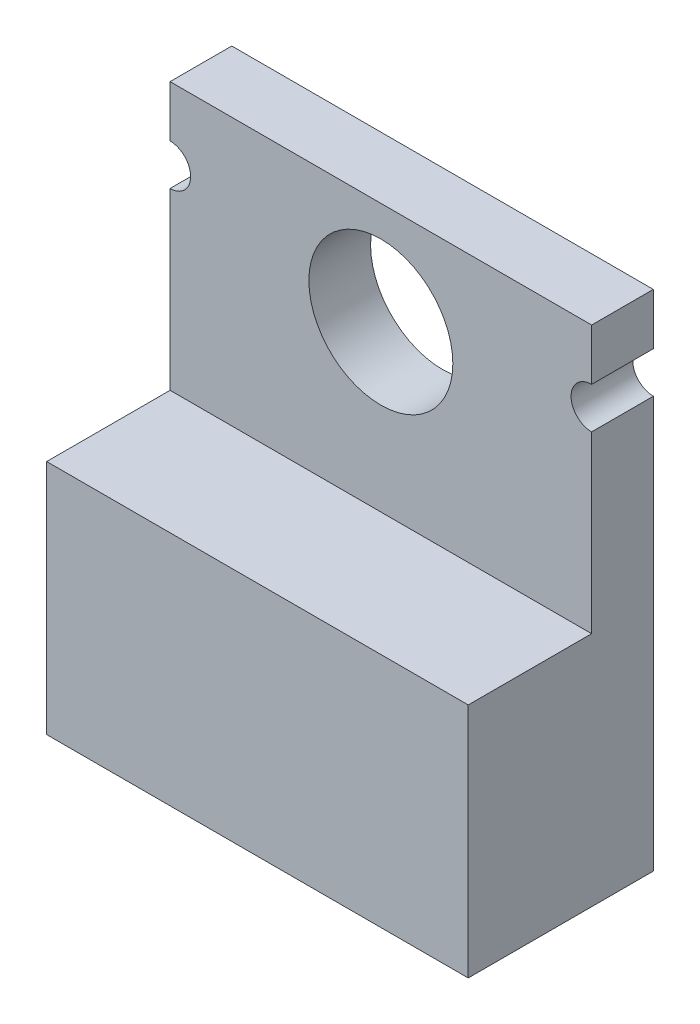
SolidWorks part; units mm, degrees
ref_plane "Front" through (0, 0, 0) normal (0, 0, 1) x (1, 0, 0)
ref_plane "Top" through (0, 0, 0) normal (0, 1, 0) x (1, 0, 0)
ref_plane "Right" through (0, 0, 0) normal (1, 0, 0) x (0, 0, -1)
sketch "Sketch1" plane through (0, 0, 0) normal (0, 0, 1) x (1, 0, 0)
  line L0 (5.207, 15.4309) -> (5.207, -2.7525) construction
  line L1 (0, 0) -> (10.414, 0)
  line L2 (0, 0) -> (0, 10.16)
  line L3 (0, 12.446) -> (10.414, 12.446)
  line L4 (10.414, 0) -> (10.414, 10.16)
  line L5 (0, 11.176) -> (0, 12.446)
  line L6 (10.414, 11.176) -> (10.414, 12.446)
  circle A0 centre (5.207, 9.906) radius 1.778
  arc A1 (0, 11.176) -> (0, 10.16) centre (0, 10.668) cw
  arc A2 (10.414, 11.176) -> (10.414, 10.16) centre (10.414, 10.668) ccw
  dimension "D3" = 2.54
  dimension "D1" = 10.414
  dimension "D2" = 12.446
extrude "Base-Extrude" add sketch "Sketch1" along normal blind 1.524
sketch "Sketch2" plane through (0, 0, 1.524) normal (0, 0, 1) x (1, 0, 0)
  line L0 (10.414, 0) -> (10.414, 10.16) construction
  line L1 (0, 0) -> (10.414, 0)
  line L2 (0, 0) -> (0, 5.842)
  line L3 (0, 5.842) -> (10.414, 5.842)
  line L4 (10.414, 0) -> (10.414, 5.842)
  dimension "D1" = 5.842
extrude "Boss-Extrude1" add sketch "Sketch2" along normal blind 3.048
